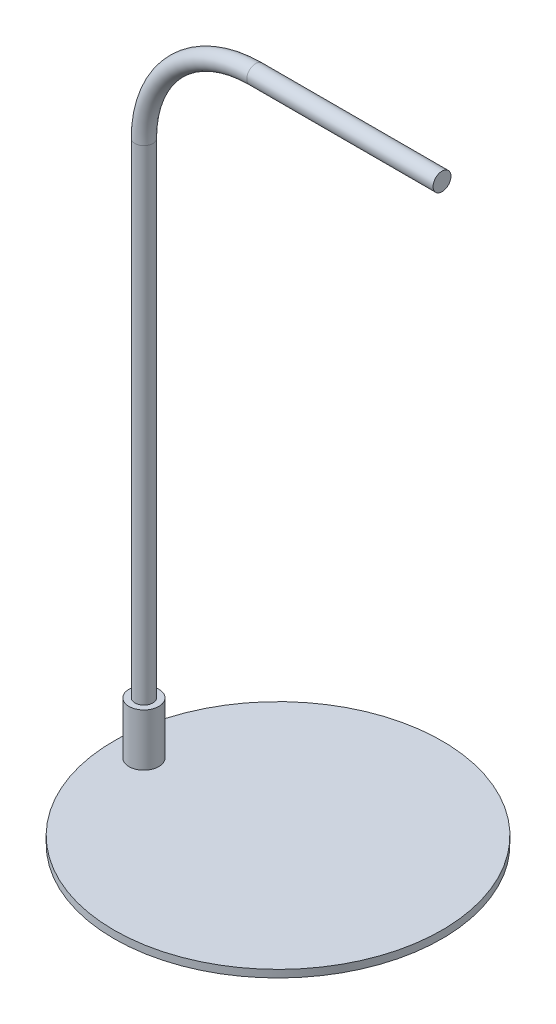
SolidWorks part; units mm, degrees
ref_plane "Alzado" through (0, 0, 0) normal (0, 0, 1) x (1, 0, 0)
ref_plane "Planta" through (0, 0, 0) normal (0, 1, 0) x (1, 0, 0)
ref_plane "Vista lateral" through (0, 0, 0) normal (1, 0, 0) x (0, 0, -1)
sketch "Croquis1" plane through (0, 0, 0) normal (0, 1, 0) x (1, 0, 0)
  circle A0 centre (0, 0) radius 110
  dimension "D1" = 220
extrude "Saliente-Extruir1" add sketch "Croquis1" along normal blind 5
sketch "Croquis4" plane through (0, 5, 0) normal (0, 1, 0) x (1, 0, 0)
  circle A0 centre (0, 0) radius 90 construction
  circle A1 centre (-90, 0) radius 10
  dimension "D1" = 180
  dimension "D2" = 20
extrude "Saliente-Extruir2" add sketch "Croquis4" along normal blind 35 separate body
sketch "Croquis5" plane through (0, 0, 0) normal (0, 0, 1) x (1, 0, 0)
  line L0 (-90, 40) -> (-90, 365)
  line L1 (-80, 40) -> (-100, 40) construction
  line L2 (-15, 440) -> (110, 440)
  arc A0 (-90, 365) -> (-15, 440) centre (-15, 365) cw
  dimension "D2" = 75
  dimension "D1" = 440
  dimension "D3" = 200
sweep "Barrer1" add path "Croquis5" parameters "D3"=12
